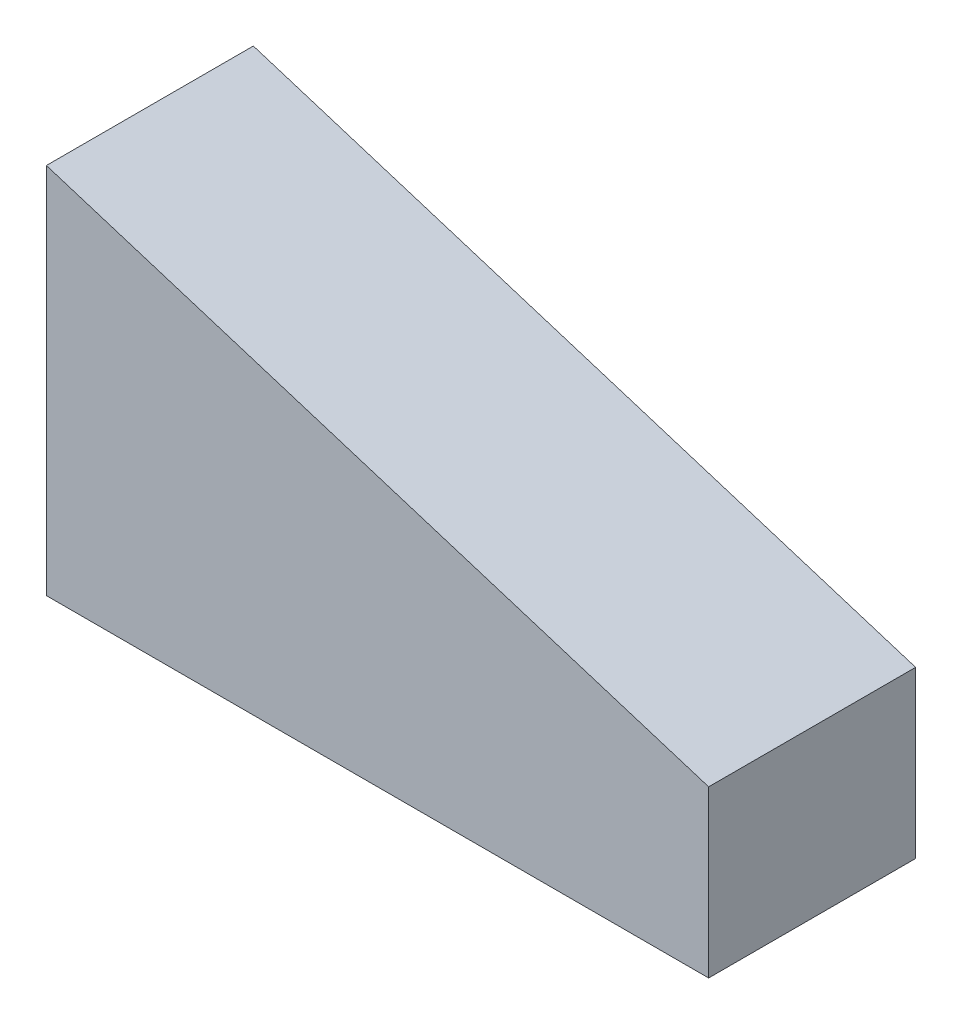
SolidWorks part; units mm, degrees
ref_plane "Front Plane" through (0, 0, 0) normal (0, 0, 1) x (1, 0, 0)
ref_plane "Top Plane" through (0, 0, 0) normal (0, 1, 0) x (1, 0, 0)
ref_plane "Right Plane" through (0, 0, 0) normal (1, 0, 0) x (0, 0, -1)
sketch "Sketch1" plane through (0, 0, 0) normal (0, 0, 1) x (1, 0, 0)
  line L1 (0, 0) -> (80, 0)
  line L2 (0, 0) -> (0, 45)
  line L3 (0, 45) -> (80, 20)
  line L4 (80, 0) -> (80, 20)
  dimension "D1" = 80
  dimension "D2" = 45
  dimension "D3" = 20
extrude "Boss-Extrude1" add sketch "Sketch1" along normal blind 25
